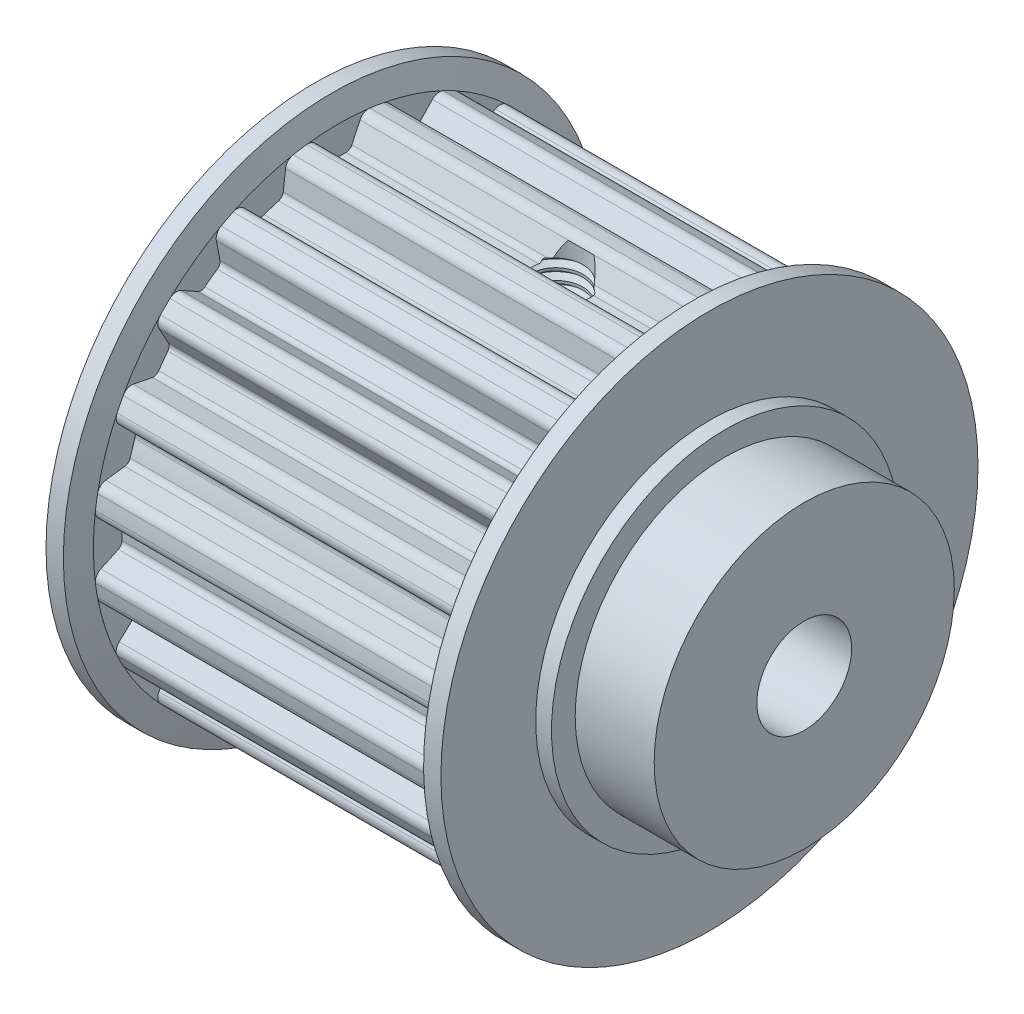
SolidWorks part; units mm, degrees
ref_plane "Front" through (0, 0, 0) normal (0, 0, 1) x (1, 0, 0)
ref_plane "Top" through (0, 0, 0) normal (0, 1, 0) x (1, 0, 0)
ref_plane "Right" through (0, 0, 0) normal (1, 0, 0) x (0, 0, -1)
imported_body "Hammashihnapyörä 20T5_20D6/0"
sketch "Sketch1" plane through (39, 0, 0) normal (1, 0, 0) x (0, 0, -1)
  line L0 (-1.5, 3.7081) -> (-1.5, 5.4)
  line L1 (-1.5, 5.4) -> (1.5, 5.4)
  line L2 (1.5, 5.4) -> (1.5, 3.7081)
  line L3 (3.994, 0.2194) -> (9.4857, 0.5211)
  line L4 (-3.0915, -2.5382) -> (2.3763, -9.198)
  circle A0 centre (0, 0) radius 9.5
  arc A1 (-1.5, 3.7081) -> (1.5, 3.7081) centre (0, 0) ccw
extrude "Boss-Extrude1" add sketch "Sketch1" against normal blind 10 contours L4 L3 M9 M6
sketch "Sketch2" plane through (39, 0, 0) normal (1, 0, 0) x (0, 0, -1)
  circle A0 centre (0, 0) radius 9.5
extrude "Cut-Extrude1" cut sketch "Sketch2" against normal blind 7
sketch "Sketch3" plane through (32, 0, 0) normal (1, 0, 0) x (0, 0, -1)
  arc A0 (-1.5, 3.7081) -> (1.5, 3.7081) centre (0, 0) ccw
  circle A1 centre (0, 0) radius 9.5
  circle A2 centre (0, 0) radius 4
  circle A3 centre (0, 0) radius 3
extrude "Boss-Extrude2" add sketch "Sketch3" against normal up to surface (32 mm away)
ref_plane "Plane1" through (0, 15.0289, 0) normal (0, -1, 0) x (-1, 0, 0)
sketch "Sketch4" plane through (0, 15.0289, 0) normal (0, -1, 0) x (-1, 0, 0)
  line L0 (-24.5, -1.3793) -> (-24.5, -0.8631) construction
  circle A0 centre (-16.5, 0) radius 1.6
  dimension "D1" = 8
extrude "Cut-Extrude2" cut sketch "Sketch4" along normal up to surface (12.4912 mm away)
thread "Thread1" pitch 0.7 start angle 0, offset 0, length 12, pitch 0.7, diameter 3.2
ref_plane "Plane2" through (18.1, 13.9221, 0) normal (0, 0, 1) x (1, 0, 0)
sketch "Thread Profile1" plane through (18.1, 13.9221, 0) normal (0, 0, 1) x (1, 0, 0)
  line L0 (0, 0) -> (0, 0.7) construction
  line L1 (0, 0) -> (0.3789, 0.2187)
  line L2 (0.3789, 0.2187) -> (0.3789, 0.3062)
  line L3 (0.3789, 0.3062) -> (0, 0.525)
  line L4 (0.3789, 0.2625) -> (0, 0.2625) construction
  line L11 (0, 0) -> (0, 0.525)
  point P2 (0, 0)
  dimension "Pitch" = 0.7
  dimension "Profile_Angle" = 60
  dimension "Profile_Land" = 0.0875
  dimension "Profile_Height" = 0.3789
ref_plane "Plane3" through (13.5, 0, 0) normal (1, 0, 0) x (0, 0, -1)
ref_plane "Plane4" through (0, 0, 0) normal (0, 0, 1) x (1, 0, 0)
sketch "Sketch8" plane through (0, 0, 0) normal (0, 0, 1) x (1, 0, 0)
  line L0 (-0.3027, 17) -> (27.3027, 17)
  line L2 (-0.3027, 17) -> (-0.3027, 18.3969)
  line L3 (-0.3027, 18.3969) -> (27.3027, 18.1783)
  line L4 (27.3027, 18.1783) -> (27.3027, 17)
  line L5 (-1000, 0) -> (49000, 0) construction
  point P3 (13.5, 17)
  dimension "D1" = 17
revolve "Cut-Revolve1" cut sketch "Sketch8" angle 360 about L5
sketch "Sketch9" plane through (0, 0, 0) normal (-1, 0, 0) x (0, 0, 1)
  circle A0 centre (0, 0) radius 8 construction
  text T0 "20T5-20D6/0" font "Century Gothic" height 2.5
extrude "Cut-Extrude3" cut sketch "Sketch9" against normal blind 0.25
sketch "Sketch10" plane through (0.9, 0, 0) normal (-1, 0, 0) x (0, 0, 1)
  circle A0 centre (0, 0) radius 12
  circle A1 centre (0, 0) radius 17
extrude "Cut-Extrude4" cut sketch "Sketch10" along normal blind 2
sketch "Sketch11" plane through (26.1, 0, 0) normal (1, 0, 0) x (0, 0, -1)
  circle A0 centre (0, 0) radius 12
  circle A1 centre (0, 0) radius 17.6848
sketch "Sketch12" plane through (26.1, 0, 0) normal (1, 0, 0) x (0, 0, -1)
  circle A0 centre (0, 0) radius 13.4087
  circle A1 centre (0, 0) radius 18.414
extrude "Cut-Extrude6" cut sketch "Sketch12" along normal blind 2
sketch "Sketch13" plane through (0.9, 0, 0) normal (-1, 0, 0) x (0, 0, 1)
  circle A0 centre (0, 0) radius 12
  circle A1 centre (0, 0) radius 17
extrude "Cut-Extrude8" cut sketch "Sketch13" against normal blind 0.1
extrude "Cut-Extrude5" cut sketch "Sketch11" against normal blind 0.1
sketch "Sketch14" plane through (27, 0, 0) normal (1, 0, 0) x (0, 0, -1)
  circle A0 centre (0, 0) radius 12
  circle A1 centre (0, 0) radius 11
extrude "Cut-Extrude9" cut sketch "Sketch14" against normal up to surface (1 mm away)
sketch "Sketch15" plane through (0, 0, 0) normal (-1, 0, 0) x (0, 0, 1)
  circle A0 centre (0, 0) radius 11
  circle A1 centre (0, 0) radius 12
extrude "Cut-Extrude10" cut sketch "Sketch15" against normal up to surface (1 mm away) contours A1 A0
